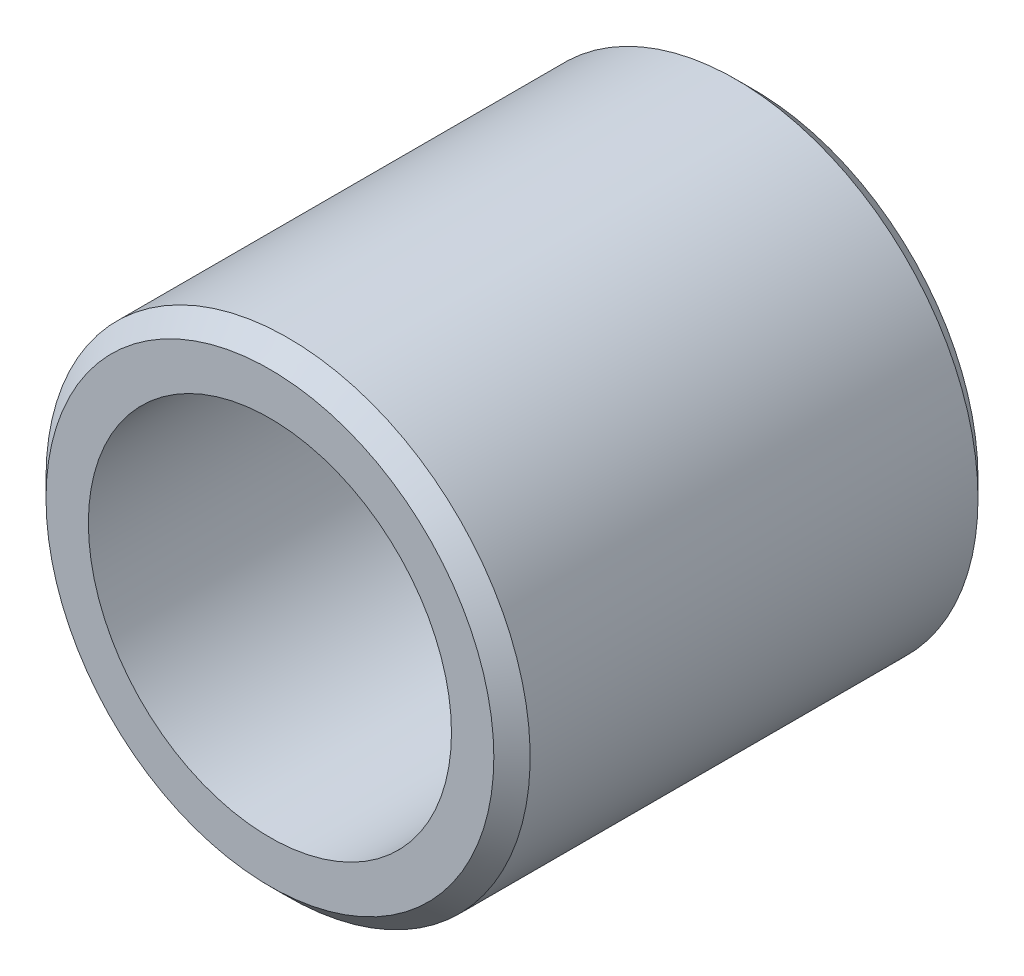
SolidWorks part; units mm, degrees
ref_plane "Face" through (0, 0, 0) normal (0, 0, 1) x (1, 0, 0)
ref_plane "Dessus" through (0, 0, 0) normal (0, 1, 0) x (1, 0, 0)
ref_plane "Droite" through (0, 0, 0) normal (1, 0, 0) x (0, 0, -1)
sketch "Esquisse1" plane through (0, 0, 0) normal (0, 0, 1) x (1, 0, 0)
  circle A0 centre (0, 0) radius 4
  point P3 (0, 0)
  dimension "D1" = 8
extrude "Extrusion1" add sketch "Esquisse1" along normal blind 8
chamfer "Chanfrein1" distance 0.3 angle 45 2 edges at (4, 0, 0) (4, 0, 8)
sketch "Esquisse2" plane through (0, 0, 8) normal (0, 0, 1) x (1, 0, 0)
  circle A0 centre (0, 0) radius 3
  dimension "D1" = 6
extrude "Enlèv. mat.-Extru.1" cut sketch "Esquisse2" against normal blind 7
sketch "Esquisse3" plane through (0, 0, 0) normal (0, 0, -1) x (-1, 0, 0)
  circle A0 centre (0, 0) radius 2.5
  dimension "D1" = 5
extrude "Enlèv. mat.-Extru.2" cut sketch "Esquisse3" against normal through all
